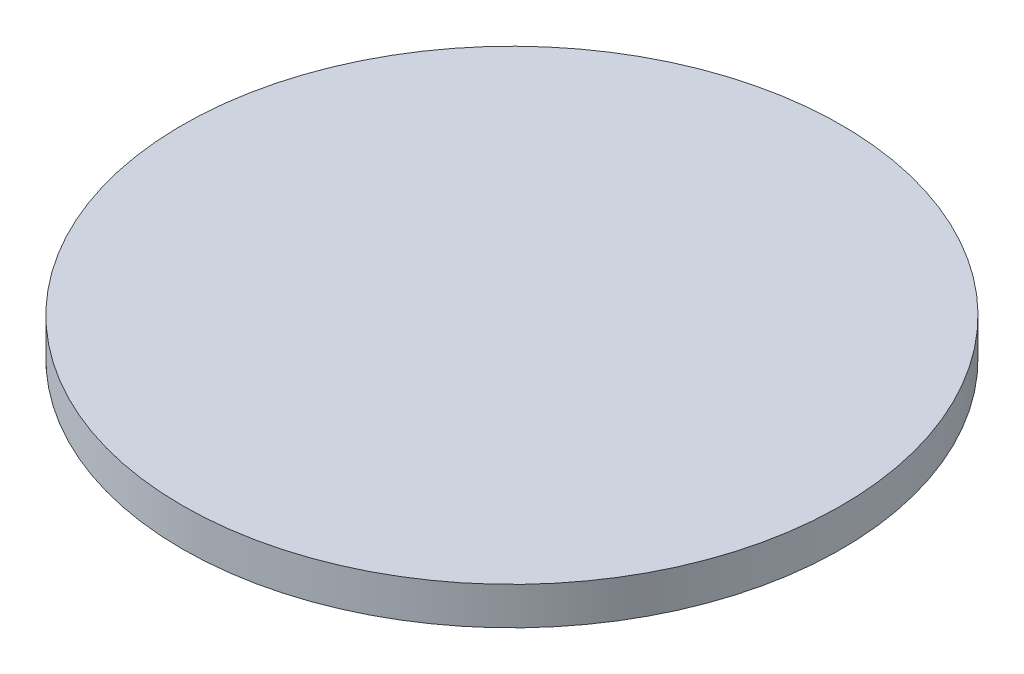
SolidWorks part; units mm, degrees
ref_plane "Plan de face" through (0, 0, 0) normal (0, 0, 1) x (1, 0, 0)
ref_plane "Plan de dessus" through (0, 0, 0) normal (0, 1, 0) x (1, 0, 0)
ref_plane "Plan de droite" through (0, 0, 0) normal (1, 0, 0) x (0, 0, -1)
sketch "Esquisse1" plane through (0, 0, 0) normal (0, 1, 0) x (1, 0, 0)
  circle A0 centre (0, 0) radius 40
  dimension "D1" = 80
extrude "Boss.-Extru.1" add sketch "Esquisse1" along normal blind 80 draft 3
sketch "Esquisse2" plane through (0, 80, 0) normal (0, 1, 0) x (1, 0, 0)
  circle A0 centre (0, 0) radius 47
  dimension "D1" = 94
extrude "Boss.-Extru.2" add sketch "Esquisse2" against normal blind 6.5
sketch "Esquisse3" plane through (0, 0, 0) normal (0, 1, 0) x (1, 0, 0)
  line L0 (-37.5877, 13.6808) -> (0, 0) construction
  line L1 (-62.2873, 13.6808) -> (-37.5877, 13.6808)
  line L2 (-62.2873, 13.6808) -> (-62.2873, -13.6808)
  line L3 (-62.2873, -13.6808) -> (-37.5877, -13.6808)
  line L4 (-37.5877, 13.6808) -> (-37.5877, -13.6808)
  line L5 (0, 0) -> (-37.5877, -13.6808) construction
  circle A1 centre (0, 0) radius 40 construction
  dimension "D1" = 40
sketch "Esquisse4" plane through (0, 0, 0) normal (0, 0, 1) x (1, 0, 0)
  line L0 (-37.5877, 0) -> (-40.4662, 54.9246)
  line L1 (-62.2873, 0) -> (-37.5877, 0) construction
  line L2 (-62.2873, 0) -> (-37.5877, 0) construction
  line L3 (-43.852, 73.5) -> (-40, 0) construction
  dimension "D1" = 55
sweep "Enlèvement de matière-Balayage1" cut profiles "Esquisse3" path "Esquisse4"
pattern_circular "Répétition circulaire1" count 8 over 360 about axis through (0, 0, 0) along (0, 1, 0) of "Enlèvement de matière-Balayage1"
fillet "Congé2" radius 3 1 edges at (0, 73.5, 47)
fillet "Congé19" [suppressed] radius 3
fillet "Congé3" radius 3 1 edges at (0, 73.5, 43.852)
fillet "Congé10" radius 2 16 edges
fillet "Congé11" radius 1 8 edges at (-42.8785, 54.9246, 0) (-30.3197, 54.9246, -30.3197) (0, 54.9246, -42.8785) (30.3197, 54.9246, -30.3197) (42.8785, 54.9246, 0) (30.3197, 54.9246, 30.3197) (0, 54.9246, 42.8785) (-30.3197, 54.9246, 30.3197)
fillet "Congé13" radius 1 40 edges at (-40.4709, 55.0144, 12.4534) (-40.438, 55.786, -14.3834) (-40.4758, 55.1077, -12.9805) (-40.4662, 54.9246, 0) (40.4662, 54.9246, 0) (28.6139, 54.9246, 28.6139) (-19.8114, 55.0144, 37.4231) (-37.7993, 55.1077, 19.4421) (40.4709, 55.0144, -12.4534) (40.4758, 55.1077, 12.9805) (40.438, 55.786, 14.3834) (37.4231, 55.0144, 19.8114) (19.4421, 55.1077, 37.7993) (18.4233, 55.786, 38.7646) (12.4534, 55.0144, 40.4709) (0, 54.9246, 40.4662) (-12.9805, 55.1077, 40.4758) (-14.3834, 55.786, 40.438) (-38.7646, 55.786, 18.4233) (-28.6139, 54.9246, 28.6139) (-37.4231, 55.0144, -19.8114) (-28.6139, 54.9246, -28.6139) (-19.4421, 55.1077, -37.7993) (-18.4233, 55.786, -38.7646) (-12.4534, 55.0144, -40.4709) (0, 54.9246, -40.4662) (12.9805, 55.1077, -40.4758) (14.3834, 55.786, -40.438) (19.8114, 55.0144, -37.4231) (28.6139, 54.9246, -28.6139) (37.7993, 55.1077, -19.4421) (38.7646, 55.786, -18.4233)
sketch "Esquisse5" plane through (0, 0, 0) normal (0, -1, 0) x (1, 0, 0)
  circle A0 centre (0, 0) radius 35
  dimension "D1" = 70
extrude "Boss.-Extru.3" add sketch "Esquisse5" along normal blind 3 draft 3
fillet "Congé14" radius 2 1 edges at (0, 0, 35)
fillet "Congé16" radius 1 16 edges at (0, 0, -37.5877) (15.3073, 0, -36.9552) (26.5785, 0, -26.5785) (36.9552, 0, -15.3073) (37.5877, 0, 0) (36.9552, 0, 15.3073) (26.5785, 0, 26.5785) (15.3073, 0, 36.9552) (0, 0, 37.5877) (-15.3073, 0, 36.9552) (-15.3073, 0, -36.9552) (-26.5785, 0, -26.5785) (-36.9552, 0, -15.3073) (-37.5877, 0, 0) (-36.9552, 0, 15.3073) (-26.5785, 0, 26.5785)
sketch "Esquisse6" plane through (0, -3, 0) normal (0, -1, 0) x (1, 0, 0)
  circle A0 centre (0, 0) radius 30
  dimension "D1" = 60
extrude "Enlèv. mat.-Extru.3" cut sketch "Esquisse6" against normal blind 3
fillet "Congé17" radius 3 1 edges at (0, 0, -30)
sketch "Esquisse7" plane through (0, 80, 0) normal (0, 1, 0) x (1, 0, 0)
  circle A0 centre (0, 0) radius 155.285
  dimension "D1" = 310.57
extrude "Boss.-Extru.4" add sketch "Esquisse7" along normal blind 10 draft 10
sketch "Esquisse8" plane through (0, 90, 0) normal (0, 1, 0) x (1, 0, 0)
  circle A0 centre (0, 0) radius 175
  dimension "D1" = 350
extrude "Boss.-Extru.5" add sketch "Esquisse8" along normal blind 20
